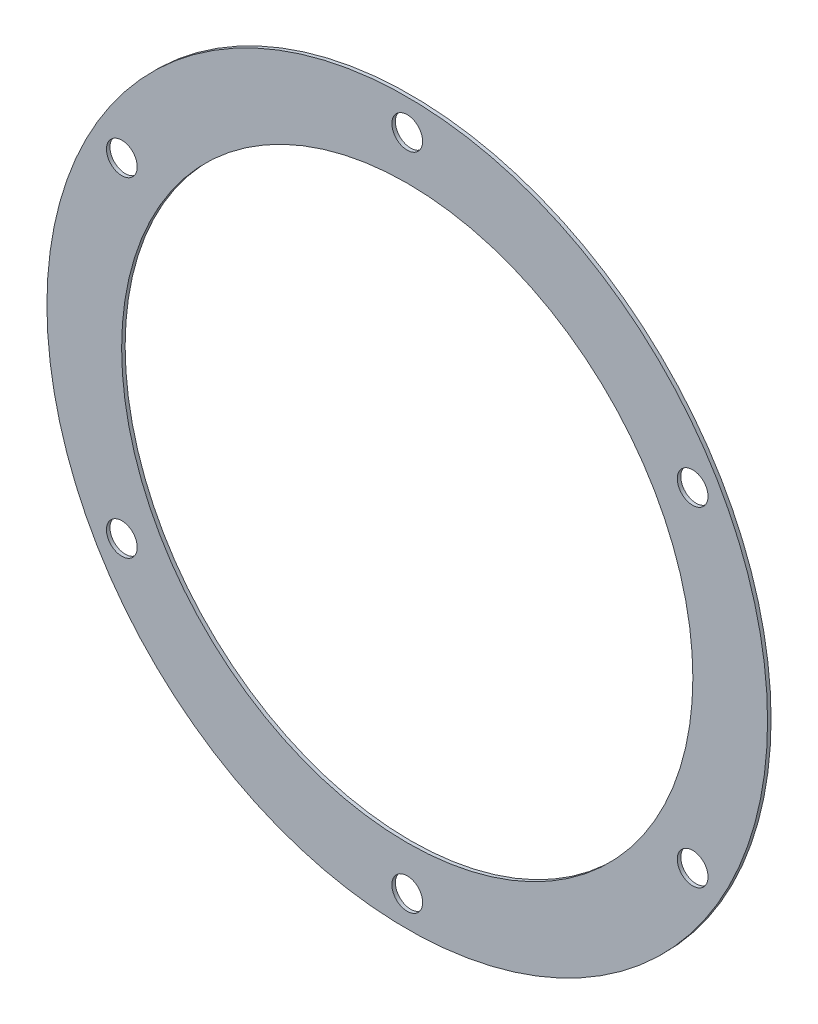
SolidWorks part; units mm, degrees
ref_plane "Front Plane" through (0, 0, 0) normal (0, 0, 1) x (1, 0, 0)
ref_plane "Top Plane" through (0, 0, 0) normal (0, 1, 0) x (1, 0, 0)
ref_plane "Right Plane" through (0, 0, 0) normal (1, 0, 0) x (0, 0, -1)
sketch "Sketch1" plane through (0, 0, 0) normal (0, 0, 1) x (1, 0, 0)
  circle A0 centre (0, 0) radius 162.5
  circle A1 centre (0, 0) radius 205
  dimension "D1" = 410
  dimension "D2" = 325
extrude "Boss-Extrude1" add sketch "Sketch1" along normal blind 2
hole_wizard "Ø17.5 (17.5) Diameter Hole1" positions "Sketch2" profile "Sketch3" hole size "Ø17.5" standard "DIN"
sketch "Sketch2" plane through (0, 0, 2) normal (0, 0, 1) x (1, 0, 0)
  line L0 (0, 0) -> (0, 187.5) construction
  circle A0 centre (0, 0) radius 187.5 construction
  circle A1 centre (0, 187.5) radius 8.75
  point P0 (0, 187.5)
  dimension "D1" = 17.5
  dimension "D2" = 375
sketch "Sketch3" plane through (0, 187.5, 2) normal (1, 0, 0) x (0, -1, 0)
  line L0 (0, 0) -> (0, 31.2575)
  line L1 (0, 31.2575) -> (8.75, 26)
  line L2 (8.75, 26) -> (8.75, 0)
  line L5 (8.75, 0) -> (0, 0)
  line L10 (0, 31.2575) -> (-8.75, 26) construction
  line L11 (0, -6.35) -> (0, 107.95) construction
  dimension "Hole Dia." = 17.5
  dimension "Hole Depth" = 26
  dimension "Drill Angle" = 118
pattern_circular "CirPattern1" count 6 over 360 about axis through (0, 0, 0) along (0, 0, 1) of "Ø17.5 (17.5) Diameter Hole1"
